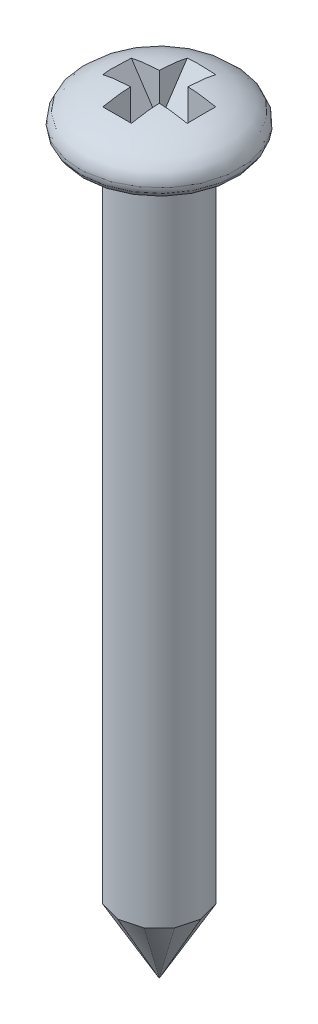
SolidWorks part; units mm, degrees
ref_plane "Plan de face" through (0, 0, 0) normal (0, 0, 1) x (1, 0, 0)
ref_plane "Plan de dessus" through (0, 0, 0) normal (0, 1, 0) x (1, 0, 0)
ref_plane "Plan de droite" through (0, 0, 0) normal (1, 0, 0) x (0, 0, -1)
ref_plane "Plan3" through (0, 6.4, 0) normal (0, 1, 0) x (-1, 0, 0)
sketch "Esquisse1" plane through (0, 6.4, 0) normal (0, 1, 0) x (-1, 0, 0)
  circle A0 centre (0, 0) radius 1.45
extrude "Extrusion1" add sketch "Esquisse1" against normal blind 25.4
sketch "Esquisse2" plane through (0, 0, 0) normal (0, 0, 1) x (1, 0, 0)
  line L0 (-3.5764, 6.4) -> (3.9855, 6.4) construction
  line L1 (0, 8.9067) -> (0, 4.7448) construction
  line L2 (-2.6992, 8) -> (4.0303, 8) construction
  line L3 (-2.8, 8.6386) -> (-2.8, 5.3938) construction
  line L4 (0, 6.4) -> (-2.3, 6.4)
  line L5 (0, 8) -> (0, 6.4)
  arc A0 (-2.3, 6.4) -> (-2.8, 6.9001) centre (-2.3, 6.9) cw
  spline S0 degree 3 poles (-2.8, 6.9001) (-2.802, 7.3106) (-1.7042, 7.9956) (-0.6729, 7.9983) (0, 8) knots 0 0 0 0 0.347597 1 1 1 1
  point P15 (-2.8, 6.4)
  point P18 (-2.8, 8)
  point P21 (0, 6.4)
  dimension "D1" = 0.5
revolve "Révolution1" add sketch "Esquisse2" angle 360 about L1
sketch "Esquisse3" plane through (0, 0, 0) normal (0, 0, 1) x (1, 0, 0)
  line L0 (0, 9.9885) -> (0, 5.1977) construction
  line L1 (-3.3122, 6.4) -> (4.0377, 6.4) construction
  line L2 (-3.6691, 0) -> (6.2564, 0) construction
  line L3 (-1.5, 8.9361) -> (-1.5, 5.7428) construction
  line L4 (-0.5, 7.218) -> (-0.5, 5.7428) construction
  line L5 (0, 8.589) -> (-1.5, 8.3981)
  line L6 (-2.5295, 7.9) -> (1.4809, 7.9) construction
  line L7 (-1.5, 8.3981) -> (-1.5, 7.9)
  line L8 (-1.5, 7.9) -> (-0.5, 6.4)
  line L9 (-0.5, 6.4) -> (0.5, 6.4)
  line L10 (1.5, 7.9) -> (0.5, 6.4)
  line L11 (1.5, 8.3981) -> (1.5, 7.9)
  line L12 (0, 8.589) -> (1.5, 8.3981)
  point P19 (0, 6.4)
extrude "Enlèv. mat.-Extru.1" cut sketch "Esquisse3" against normal mid plane 1
pattern_circular "Répétition circulaire1" count 2 every 90 about axis through (0, 0, 0) along (0, 1, 0) of "Enlèv. mat.-Extru.1"
chamfer "Chanfrein1" distance 1.44 distance2 2.5 1 edges at (0, -19, 1.45)
